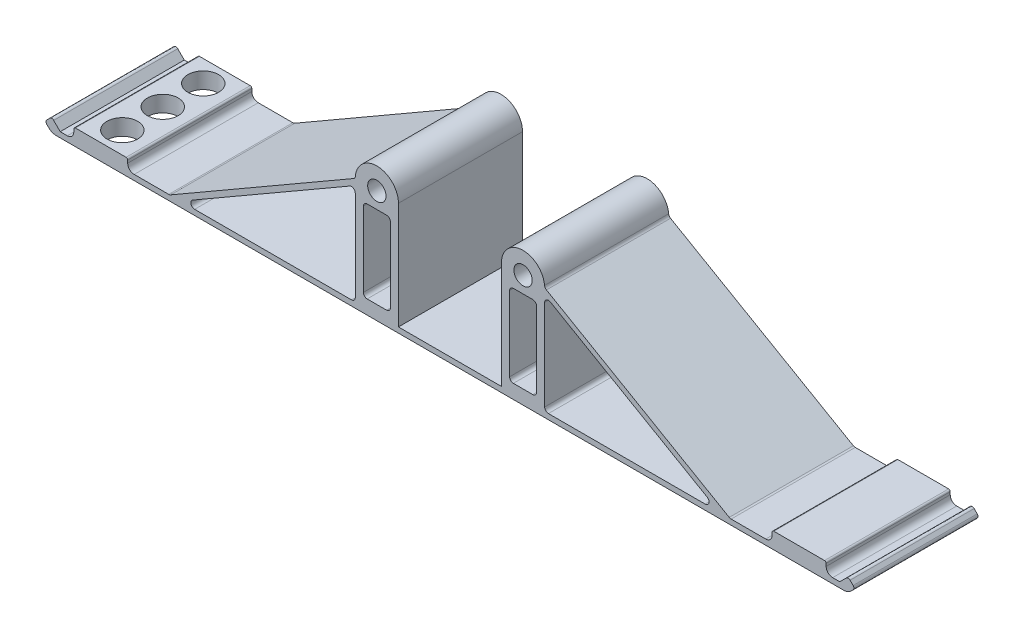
SolidWorks part; units mm, degrees
ref_plane "前视基准面" through (0, 0, 0) normal (0, 0, 1) x (1, 0, 0)
ref_plane "上视基准面" through (0, 0, 0) normal (0, 1, 0) x (1, 0, 0)
ref_plane "右视基准面" through (0, 0, 0) normal (1, 0, 0) x (0, 0, -1)
other "Configuration Table"
sketch "草图1" plane through (0, 0, 0) normal (0, 0, 1) x (1, 0, 0)
  line L1 (-72.9584, -95) -> (72.9584, -95) construction
  line L2 (27.2412, -94) -> (17, -94)
  line L3 (-72.9584, -95) -> (72.9584, -95)
  line L4 (0, -95) -> (0, -89.7182) construction
  line L5 (-27.2412, -94) -> (-72.2412, -94)
  line L6 (-74.3726, -94.4142) -> (-74.7261, -94.0607)
  line L7 (-94.4142, -74.3726) -> (-74.3726, -94.4142) construction
  line L8 (-74.7261, -93.3536) -> (-74.1605, -92.7879)
  line L9 (-73.4533, -92.7879) -> (-72.2412, -94)
  line L10 (-17, -94) -> (-25.2412, -94)
  line L11 (-17, -94) -> (17, -94)
  line L12 (-25.2412, -94) -> (-27.2412, -94)
  line L13 (73.4533, -92.7879) -> (72.2412, -94)
  line L14 (74.7261, -93.3536) -> (74.1605, -92.7879)
  line L15 (74.3726, -94.4142) -> (74.7261, -94.0607)
  line L16 (27.2412, -94) -> (72.2412, -94)
  line L17 (17.55, -74.15) -> (17.55, -94)
  line L18 (9.55, -74.15) -> (9.55, -94)
  line L19 (51.9312, -94) -> (17.55, -74.15)
  line L22 (49.9312, -94) -> (17.55, -75.3047)
  line L23 (-11.05, -77.15) -> (-11.05, -92.4)
  line L24 (51.4312, -94.866) -> (17.05, -75.016) construction
  line L25 (16.05, -77.15) -> (11.05, -77.15)
  line L26 (16.05, -77.15) -> (16.05, -92.4)
  line L27 (16.05, -92.4) -> (11.05, -92.4)
  line L28 (11.05, -77.15) -> (11.05, -92.4)
  line L29 (-16.05, -92.4) -> (-11.05, -92.4)
  line L30 (-16.05, -77.15) -> (-16.05, -92.4)
  line L31 (-16.05, -77.15) -> (-11.05, -77.15)
  line L32 (-49.9312, -94) -> (-17.55, -75.3047)
  line L33 (-51.9312, -94) -> (-17.55, -74.15)
  line L34 (-9.55, -74.15) -> (-9.55, -94)
  line L35 (-17.55, -74.15) -> (-17.55, -94)
  line L36 (-27.2412, -94) -> (-17, -94)
  arc A0 (-74.3726, -94.4142) -> (-72.9584, -95) centre (-72.9584, -93) ccw construction
  arc A1 (-74.3726, -94.4142) -> (-72.9584, -95) centre (-72.9584, -93) ccw
  arc A2 (72.9584, -95) -> (74.3726, -94.4142) centre (72.9584, -93) ccw construction
  arc A3 (72.9584, -95) -> (74.3726, -94.4142) centre (72.9584, -93) ccw
  arc A4 (-74.7261, -94.0607) -> (-74.7261, -93.3536) centre (-74.3726, -93.7071) cw
  arc A5 (-74.1605, -92.7879) -> (-73.4533, -92.7879) centre (-73.8069, -93.1414) cw
  circle A6 centre (13.55, -74.15) radius 1.7
  circle A7 centre (13.55, -74.15) radius 4
  circle A8 centre (-13.55, -74.15) radius 4
  circle A9 centre (-13.55, -74.15) radius 1.7
  arc A14 (74.1605, -92.7879) -> (73.4533, -92.7879) centre (73.8069, -93.1414) ccw
  arc A15 (74.7261, -94.0607) -> (74.7261, -93.3536) centre (74.3726, -93.7071) ccw
  arc A16 (74.3726, -94.4142) -> (72.9584, -95) centre (72.9584, -93) cw
  point P17 (-75.0797, -93.7071)
  point P20 (-73.8069, -92.4343)
  point P27 (-25.2412, -94)
  point P30 (-19, -94)
  point P46 (-25.2412, -94)
  point P54 (0, -94)
  point P57 (19, -94)
  point P58 (25.2412, -94)
  point P59 (73.8069, -92.4343)
  point P60 (75.0797, -93.7071)
  dimension "D4" = 0.5
  dimension "D9" = 8
  dimension "D10" = 30
  dimension "D11" = 1
  dimension "D12" = 1.5
  dimension "D6" = 3.4
  dimension "D1" = 47
  dimension "D2" = 1.8
  dimension "D3" = 1
  dimension "D5" = 19
  dimension "D7" = 1
  dimension "D8" = 1
  dimension "D13" = 1.5
  dimension "D14" = 1.6
  dimension "D15" = 3
extrude "凸台-拉伸1" add sketch "草图1" along normal blind 23
fillet "圆角1" radius 0.7 18 edges at (-51.9312, -94, 11.5) (-17.55, -74.15, 11.5) (17.55, -74.15, 11.5) (51.9312, -94, 11.5) (-49.9312, -94, 11.5) (-17.55, -94, 11.5) (-17.55, -75.3047, 11.5) (-16.05, -77.15, 11.5) (-16.05, -92.4, 11.5) (-11.05, -92.4, 11.5) (-11.05, -77.15, 11.5) (17.55, -94, 11.5) (49.9312, -94, 11.5) (17.55, -75.3047, 11.5) (11.05, -92.4, 11.5) (16.05, -92.4, 11.5) (16.05, -77.15, 11.5) (11.05, -77.15, 11.5)
sketch "草图2" plane through (0, -95, 0) normal (0, -1, 0) x (1, 0, 0)
  line L0 (0, 0) -> (0, 23) construction
  line L2 (-72.9584, 23) -> (72.9584, 23) construction
  line L3 (0, 11.5) -> (-38.6794, 11.5) construction
  line L4 (-74.7261, 23) -> (-74.7261, 0) construction
  circle A0 centre (-64.7261, 11.5) radius 2.85
  circle A1 centre (-64.7261, 19) radius 2.85
  circle A2 centre (-64.7261, 4) radius 2.85
  dimension "D1" = 5.7
  dimension "D3" = 15
  dimension "D2" = 10
extrude "切除-拉伸1" cut sketch "草图2" against normal blind 10
sketch "草图3" plane through (0, -94, 0) normal (0, 1, 0) x (1, 0, 0)
  line L0 (-64.7261, -11.5) -> (-64.7261, -29.8333) construction
  line L1 (-72.2412, -23) -> (-52.1188, -23) construction
  line L2 (-69.7261, -23) -> (-59.7261, -23)
  line L3 (-69.7261, -23) -> (-69.7261, 0)
  line L4 (-69.7261, 0) -> (-59.7261, 0)
  line L5 (-59.7261, -23) -> (-59.7261, 0)
  line L6 (-72.2412, 0) -> (-52.1188, 0) construction
  circle A0 centre (-64.7261, -19) radius 2.85 construction
  circle A1 centre (-64.7261, -11.5) radius 2.85 construction
  circle A2 centre (-64.7261, -4) radius 2.85 construction
  circle A3 centre (-64.7261, -4) radius 2.85
  circle A4 centre (-64.7261, -11.5) radius 2.85
  circle A5 centre (-64.7261, -19) radius 2.85
  dimension "D1" = 10
extrude "凸台-拉伸2" add sketch "草图3" along normal blind 2
fillet "圆角2" radius 0.3 2 edges at (-59.7261, -92, 11.5) (-69.7261, -92, 11.5)
fillet "圆角3" radius 1.2 2 edges at (-69.7261, -94, 11.5) (-59.7261, -94, 11.5)
mirror "镜向1" about plane through (0, 0, 0) normal (1, 0, 0) of "切除-拉伸1", "圆角3", "圆角2", "凸台-拉伸2"
sketch "草图4" plane through (0, -95, 0) normal (0, -1, 0) x (1, 0, 0)
  circle A0 centre (64.7261, 4) radius 2.85 construction
  circle A1 centre (64.7261, 11.5) radius 2.85 construction
  circle A2 centre (64.7261, 19) radius 2.85 construction
  circle A3 centre (64.7261, 4) radius 2.85
  circle A4 centre (64.7261, 11.5) radius 2.85
  circle A5 centre (64.7261, 19) radius 2.85
extrude "凸台-拉伸3" add sketch "草图4" against normal up to surface (3 mm away)
